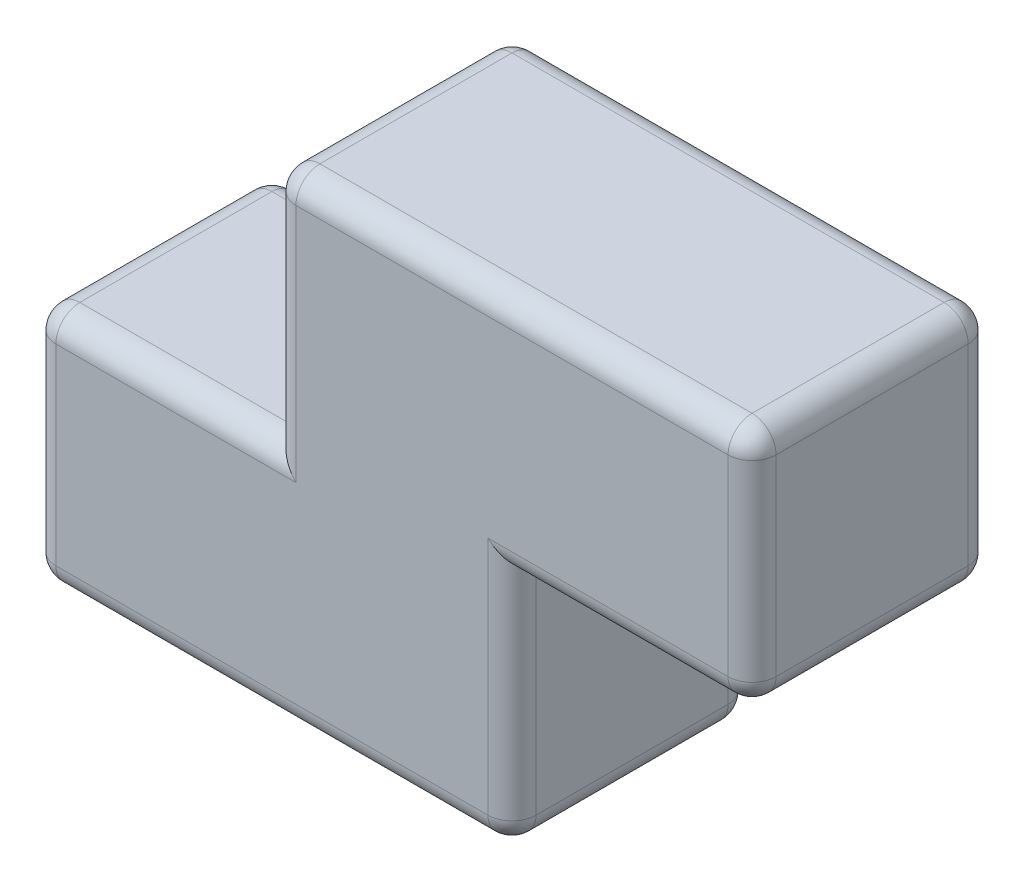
SolidWorks part; units mm, degrees
ref_plane "Front Plane" through (0, 0, 0) normal (0, 0, 1) x (1, 0, 0)
ref_plane "Top Plane" through (0, 0, 0) normal (0, 1, 0) x (1, 0, 0)
ref_plane "Right Plane" through (0, 0, 0) normal (1, 0, 0) x (0, 0, -1)
sketch "Sketch1" plane through (0, 0, 0) normal (0, 0, 1) x (1, 0, 0)
  line L14 (-443.1968, 140.8925) -> (-443.1968, -120.1115) construction
  line L19 (-859.9935, 14.7403) -> (-859.9935, -85.2597)
  line L20 (-759.9935, -85.2597) -> (-859.9935, -85.2597)
  line L21 (-759.9935, 14.7403) -> (-859.9935, 14.7403)
  line L22 (-659.9935, -85.2597) -> (-759.9935, -85.2597)
  line L23 (-659.9935, 14.7403) -> (-659.9935, -85.2597)
  line L24 (-759.9935, 114.7403) -> (-759.9935, 14.7403)
  line L25 (-559.9935, 14.7403) -> (-659.9935, 14.7403)
  line L26 (-559.9935, 114.7403) -> (-559.9935, 14.7403)
  line L27 (-559.9935, 114.7403) -> (-759.9935, 114.7403)
extrude "Boss-Extrude1" add sketch "Sketch1" along normal blind 100
fillet "Fillet4" radius 10 22 edges at (-659.9935, -35.2597, 0) (-609.9935, 14.7403, 0) (-759.9935, 64.7403, 0) (-809.9935, 14.7403, 0) (-659.9935, -85.2597, 50) (-759.9935, -85.2597, 0) (-859.9935, 14.7403, 50) (-859.9935, -85.2597, 50) (-859.9935, -35.2597, 0) (-559.9935, 14.7403, 50) (-559.9935, 64.7403, 0) (-759.9935, 64.7403, 100) (-559.9935, 64.7403, 100) (-609.9935, 14.7403, 100) (-659.9935, -35.2597, 100) (-759.9935, -85.2597, 100) (-859.9935, -35.2597, 100) (-809.9935, 14.7403, 100) (-559.9935, 114.7403, 50) (-659.9935, 114.7403, 100) (-759.9935, 114.7403, 50) (-659.9935, 114.7403, 0)
